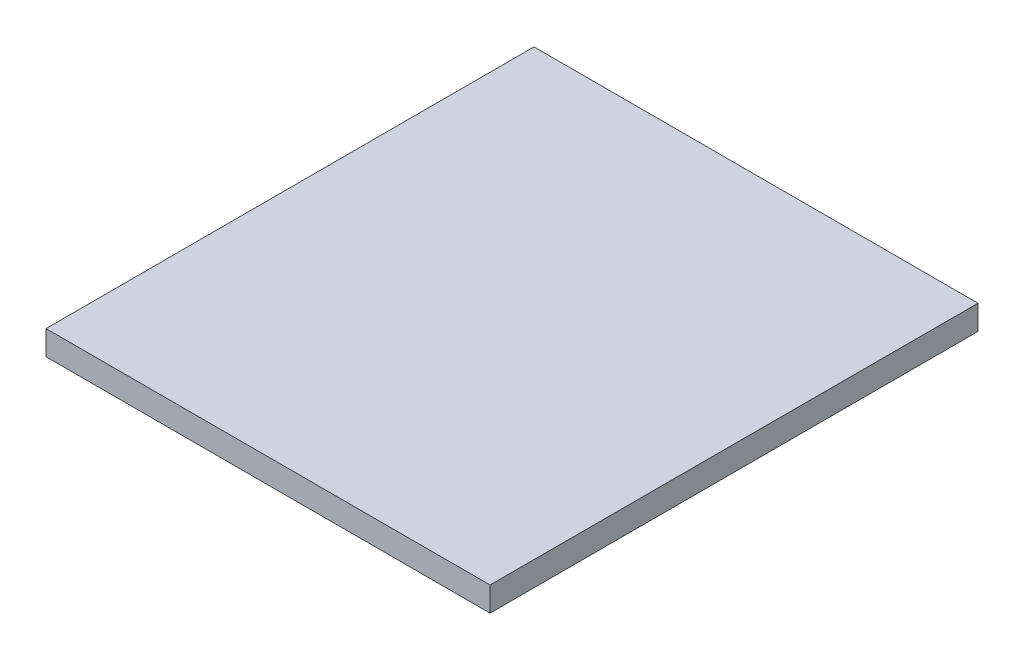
SolidWorks part; units mm, degrees
ref_plane "Front Plane" through (0, 0, 0) normal (0, 0, 1) x (1, 0, 0)
ref_plane "Top Plane" through (0, 0, 0) normal (0, 1, 0) x (1, 0, 0)
ref_plane "Right Plane" through (0, 0, 0) normal (1, 0, 0) x (0, 0, -1)
sketch "Sketch1" plane through (0, 0, 0) normal (0, 0, 1) x (1, 0, 0)
  line L1 (-45.5, 5) -> (45.5, 5)
  line L2 (-45.5, 5) -> (-45.5, 0)
  line L3 (-45.5, 0) -> (45.5, 0)
  line L4 (45.5, 5) -> (45.5, 0)
  dimension "D1" = 5
  dimension "D2" = 91
extrude "Extrude1" add sketch "Sketch1" along normal blind 100
